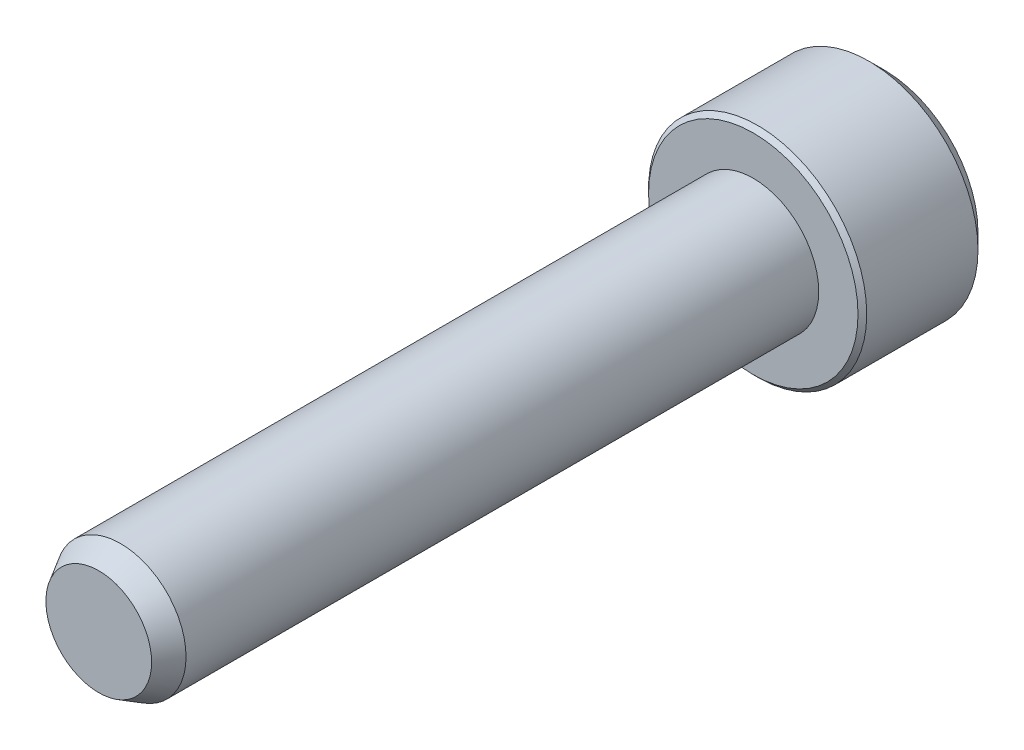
SolidWorks part; units mm, degrees
ref_plane "Plan1" through (0, 0, 0) normal (0, 0, 1) x (1, 0, 0)
ref_plane "Plan2" through (0, 0, 0) normal (0, 1, 0) x (1, 0, 0)
ref_plane "Plan3" through (0, 0, 0) normal (1, 0, 0) x (0, 0, -1)
sketch "Esquisse1" plane through (0, 0, 0) normal (0, 0, 1) x (1, 0, 0)
  circle A0 centre (0, 0) radius 3
  dimension "D1" = 6
extrude "Base-Extrusion" add sketch "Esquisse1" along normal blind 30
sketch "Esquisse2" plane through (0, 0, 0) normal (0, 0, 1) x (1, 0, 0)
  circle A0 centre (0, 0) radius 5
  dimension "D1" = 10
extrude "Boss.-Extru.1" add sketch "Esquisse2" against normal blind 6
ref_plane "Plan4" through (0, 0, -6) normal (0, 0, 1) x (1, 0, 0)
sketch "Esquisse3" plane through (0, 0, -6) normal (0, 0, 1) x (1, 0, 0)
  line L0 (-1.4434, 2.5) -> (1.4434, 2.5)
  line L1 (-1.4434, -2.5) -> (1.4434, -2.5)
  line L2 (-1.4434, 2.5) -> (-2.8868, 0)
  line L3 (1.4434, -2.5) -> (2.8868, 0)
  line L4 (-2.8868, 0) -> (-1.4434, -2.5)
  line L6 (1.4434, 2.5) -> (2.8868, 0)
extrude "Enlèv. mat.-Extru.1" cut sketch "Esquisse3" along normal blind 3
chamfer "Chanfrein1" distance 0.7 angle 45
chamfer "Chanfrein2" distance 1 angle 30
chamfer "Chanfrein3" distance 0.2 angle 45
